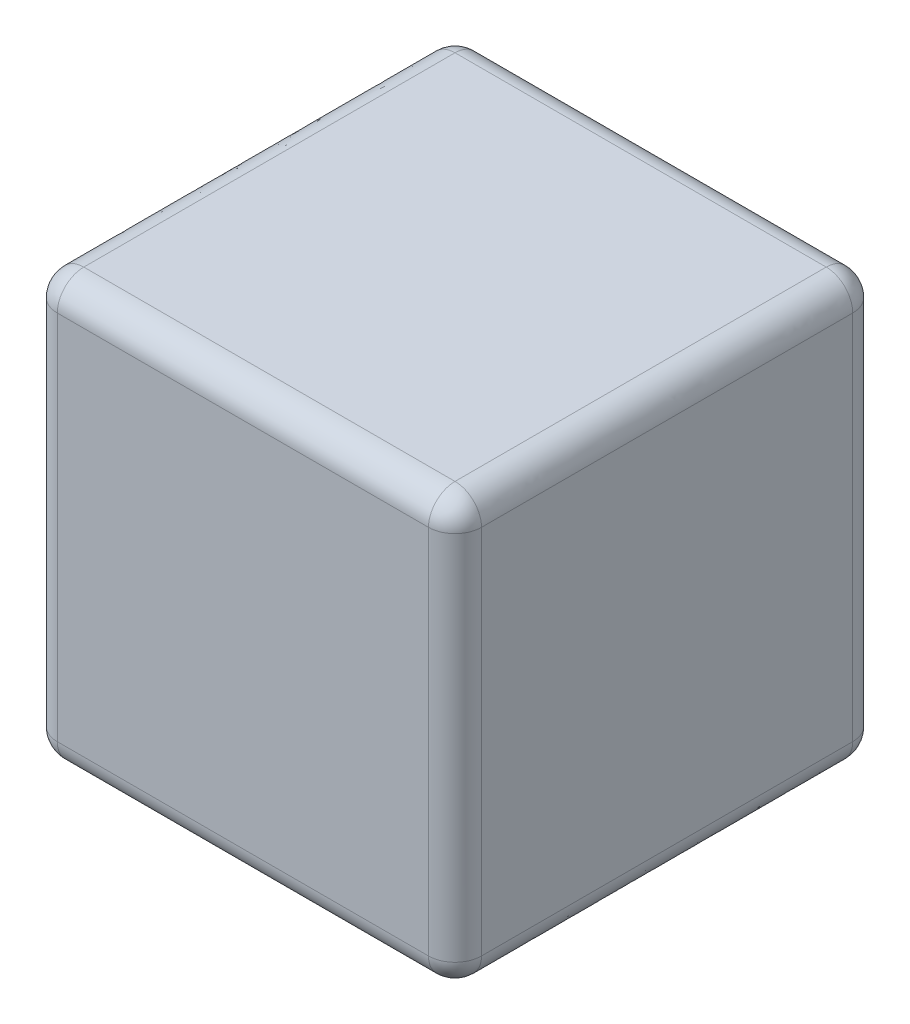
SolidWorks part; units mm, degrees
ref_plane "Front Plane" through (0, 0, 0) normal (0, 0, 1) x (1, 0, 0)
ref_plane "Top Plane" through (0, 0, 0) normal (0, 1, 0) x (1, 0, 0)
ref_plane "Right Plane" through (0, 0, 0) normal (1, 0, 0) x (0, 0, -1)
sketch "Sketch1" plane through (0, 0, 0) normal (0, 0, 1) x (1, 0, 0)
  line L0 (-231.4625, 122.5056) -> (-203.4625, 122.5056)
  line L1 (-201.4625, 120.5056) -> (-201.4625, 92.5056)
  line L2 (-203.4625, 90.5056) -> (-231.4625, 90.5056)
  line L3 (-233.4625, 92.5056) -> (-233.4625, 120.5056)
  spline S0 degree 3 poles (-203.4625, 122.5056) (-202.3609, 122.5056) (-201.4625, 121.6072) (-201.4625, 120.5056) knots 0.125 0.125 0.125 0.125 0.25 0.25 0.25 0.25
  spline S1 degree 3 poles (-201.4625, 92.5056) (-201.4625, 91.404) (-202.3609, 90.5056) (-203.4625, 90.5056) knots 0.375 0.375 0.375 0.375 0.5 0.5 0.5 0.5
  spline S2 degree 3 poles (-231.4625, 90.5056) (-232.5641, 90.5056) (-233.4625, 91.404) (-233.4625, 92.5056) knots 0.625 0.625 0.625 0.625 0.75 0.75 0.75 0.75
  spline S3 degree 3 poles (-233.4625, 120.5056) (-233.4625, 121.6072) (-232.5641, 122.5056) (-231.4625, 122.5056) knots 0.875 0.875 0.875 0.875 1 1 1 1
extrude "Boss-Extrude1" add sketch "Sketch1" along normal blind 32
fillet "Fillet1" radius 2 16 edges at (-233.4625, 106.5056, 0) (-217.4625, 90.5056, 0) (-201.4625, 106.5056, 0) (-217.4625, 122.5056, 0) (-217.4625, 122.5056, 32) (-201.4625, 106.5056, 32) (-217.4625, 90.5056, 32) (-233.4625, 106.5056, 32)
